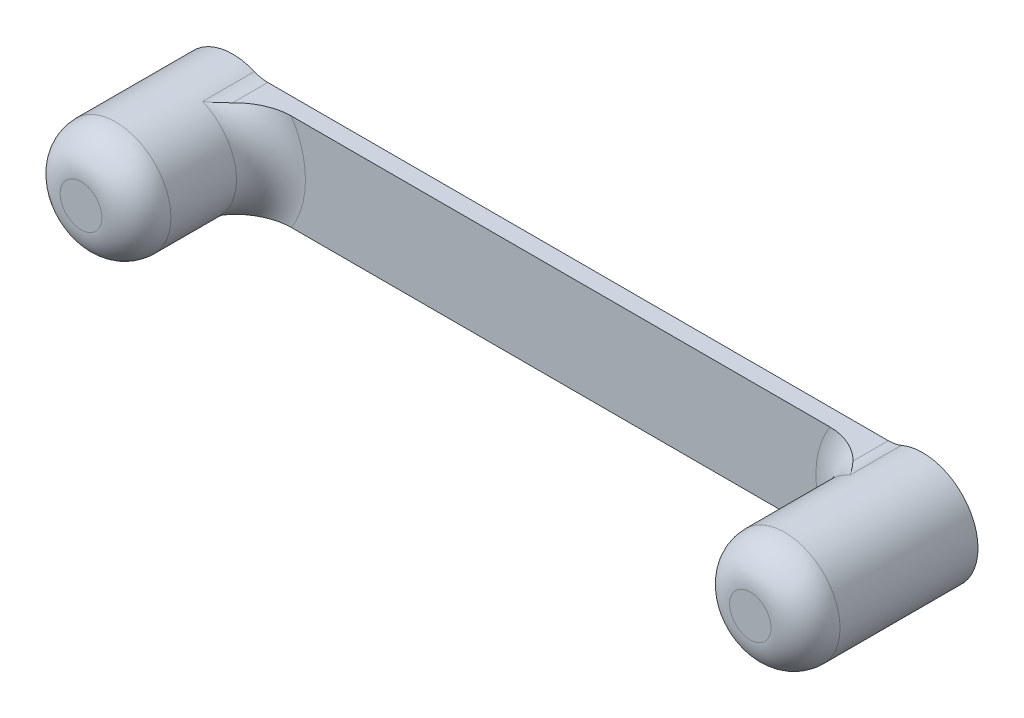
SolidWorks part; units mm, degrees
ref_plane "Front Plane" through (0, 0, 0) normal (0, 0, 1) x (1, 0, 0)
ref_plane "Top Plane" through (0, 0, 0) normal (0, 1, 0) x (1, 0, 0)
ref_plane "Right Plane" through (0, 0, 0) normal (1, 0, 0) x (0, 0, -1)
sketch "Sketch1" plane through (0, 0, 0) normal (0, 0, 1) x (1, 0, 0)
  circle A1 centre (0, 0) radius 4.064
  dimension "D1" = 8.128
extrude "Boss-Extrude1" add sketch "Sketch1" along normal blind 12.7
sketch "Sketch2" plane through (0, 0, 0) normal (0, 0, -1) x (-1, 0, 0)
  circle A0 centre (0, 0) radius 3.5687
  dimension "D1" = 7.1374
extrude "Cut-Extrude1" cut sketch "Sketch2" against normal blind 10.922
fillet "Fillet1" radius 2.54 2 edges at (-3.5687, 0, 10.922) (4.064, 0, 12.7)
sketch "Sketch3" plane through (0, 0, 0) normal (0, 0, 1) x (1, 0, 0)
  line L0 (-48.8064, 3.556) -> (-48.8064, -3.556)
  line L1 (-48.8064, 3.556) -> (-1.9675, 3.556)
  line L3 (-48.8064, -3.556) -> (-1.9675, -3.556)
  circle A0 centre (0, 0) radius 4.064 construction
  arc A1 (-1.9675, 3.556) -> (-1.9675, -3.556) centre (0, 0) ccw
  arc A2 (-48.8064, 3.556) -> (-48.8064, -3.556) centre (-50.8, 0) ccw construction
  dimension "D2" = 4.064
  dimension "D4" = 8.1534
  dimension "D1" = 50.8
  dimension "D3" = 7.112
extrude "Boss-Extrude2" add sketch "Sketch3" along normal blind 1.27
sketch "Sketch4" plane through (0, 0, 0) normal (0, 0, 1) x (1, 0, 0)
  circle A0 centre (-50.8, 0) radius 4.0767
extrude "Boss-Extrude3" add sketch "Sketch4" along normal blind 11.176
sketch "Sketch5" plane through (0, 0, 0) normal (0, 0, -1) x (-1, 0, 0)
  circle A0 centre (50.8, 0) radius 3.5687
  dimension "D1" = 7.1374
extrude "Cut-Extrude2" cut sketch "Sketch5" against normal blind 9.398
fillet "Fillet2" radius 2.54 2 edges at (-54.3687, 0, 9.398) (-46.7233, 0, 11.176)
sketch "Sketch6" plane through (0, 0, 0) normal (0, 0, -1) x (-1, 0, 0)
  line L0 (48.8064, -3.556) -> (1.9675, -3.556) construction
  text T0 "3F" font "Stencil" height 5.08
  text T1 "4F" font "Stencil" height 5.08
  dimension "D1" = 1.016
  dimension "D2" = 4.318
extrude "Cut-Extrude3" cut sketch "Sketch6" against normal blind 0.508
fillet "Fillet3" radius 2.54 6 edges at (-4.064, 0, 1.27) (-46.7233, 0, 1.27) (-48.8064, 3.556, 0.635) (-48.8064, -3.556, 0.635) (-1.9675, -3.556, 0.635) (-1.9675, 3.556, 0.635)
